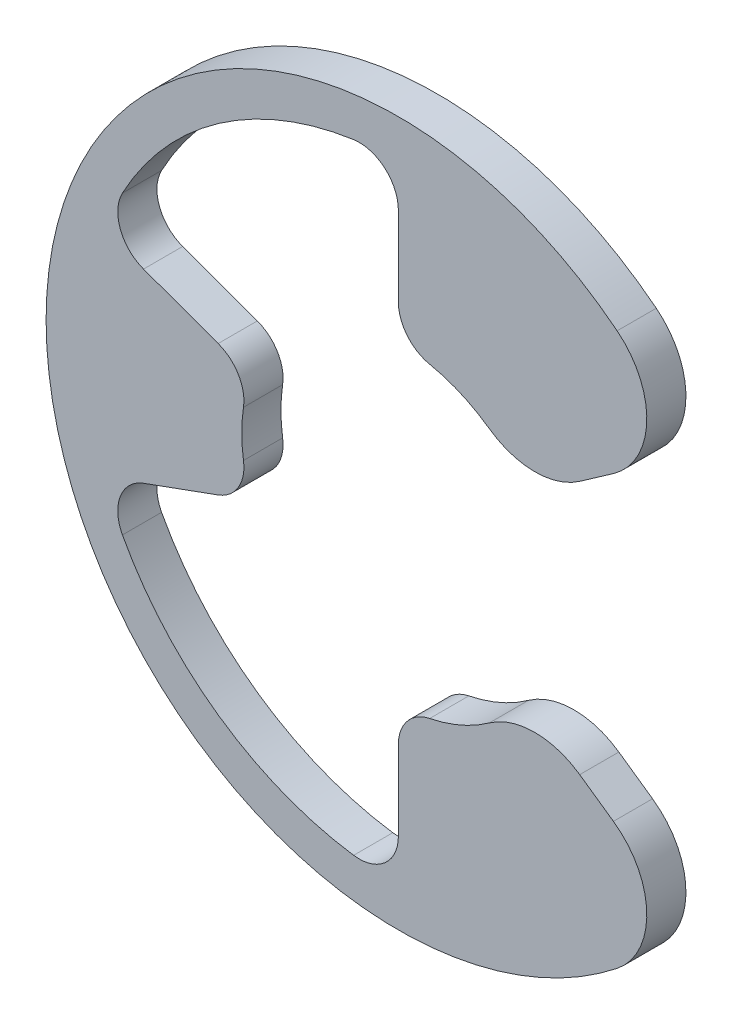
SolidWorks part; units mm, degrees
ref_plane "Plan1" through (0, 0, 0) normal (0, 0, 1) x (1, 0, 0)
ref_plane "Plan2" through (0, 0, 0) normal (0, 1, 0) x (1, 0, 0)
ref_plane "Plan3" through (0, 0, 0) normal (1, 0, 0) x (0, 0, -1)
sketch "Esquisse1" plane through (0, 0, 0) normal (0, 0, 1) x (1, 0, 0)
  line L0 (0, 3.4641) -> (0, 2.4495)
  line L1 (0, -3.4641) -> (0, -2.4495)
  line L2 (2.3169, 1.6223) -> (2.7475, 1.9238)
  line L3 (2.3169, -1.6223) -> (2.7475, -1.9238)
  line L4 (-2.3018, 0.8378) -> (-3.2552, 1.1848)
  line L5 (-2.3018, -0.8378) -> (-3.2552, -1.1848)
  line L6 (0, 0) -> (-10, 0) construction
  arc A0 (2.7951, 3.5267) -> (2.7951, -3.5267) centre (0, 0) ccw
  arc A1 (-0.5714, 3.959) -> (-3.5248, 1.891) centre (0, 0) ccw
  arc A2 (-1.9782, 0.2943) -> (-1.9782, -0.2943) centre (0, 0) ccw
  arc A3 (0.4, -1.9596) -> (1.1622, -1.6276) centre (0, 0) ccw
  arc A4 (-3.5248, -1.891) -> (-0.5714, -3.959) centre (0, 0) ccw
  arc A5 (-3.5248, 1.891) -> (-3.2552, 1.1848) centre (-3.0842, 1.6546) ccw
  arc A6 (-3.5248, -1.891) -> (-3.2552, -1.1848) centre (-3.0842, -1.6546) cw
  arc A7 (-0.5714, -3.959) -> (0, -3.4641) centre (-0.5, -3.4641) ccw
  arc A8 (-0.5714, 3.959) -> (0, 3.4641) centre (-0.5, 3.4641) cw
  arc A9 (-1.9782, 0.2943) -> (-2.3018, 0.8378) centre (-2.4728, 0.3679) ccw
  arc A10 (-1.9782, -0.2943) -> (-2.3018, -0.8378) centre (-2.4728, -0.3679) cw
  arc A11 (0.4, 1.9596) -> (0, 2.4495) centre (0.5, 2.4495) cw
  arc A12 (0.4, -1.9596) -> (0, -2.4495) centre (0.5, -2.4495) ccw
  arc A13 (1.1622, 1.6276) -> (0.4, 1.9596) centre (0, 0) ccw
  arc A14 (2.7951, 3.5267) -> (2.7475, 1.9238) centre (2.1739, 2.743) cw
  arc A15 (2.7951, -3.5267) -> (2.7475, -1.9238) centre (2.1739, -2.743) ccw
  arc A16 (1.1622, -1.6276) -> (2.3169, -1.6223) centre (1.7433, -2.4415) cw
  arc A17 (1.1622, 1.6276) -> (2.3169, 1.6223) centre (1.7433, 2.4415) ccw
  point P5 (-3.7588, 1.3681)
  point P20 (-3.7588, -1.3681)
  point P27 (-1.8794, 0.684)
  point P30 (-1.8794, -0.684)
  point P35 (0, -2)
  point P38 (3.6862, 2.5811)
  point P41 (3.6862, -2.5811)
  point P44 (1.6383, -1.1472)
  point P47 (1.6383, 1.1472)
  dimension "D1" = 8
  dimension "D2" = 9
  dimension "D3" = 4
  dimension "D6" = 0.5
  dimension "D7" = 1
  dimension "D4" = 20
  dimension "D5" = 35
extrude "Base-Extrusion" add sketch "Esquisse1" along normal blind 0.5
